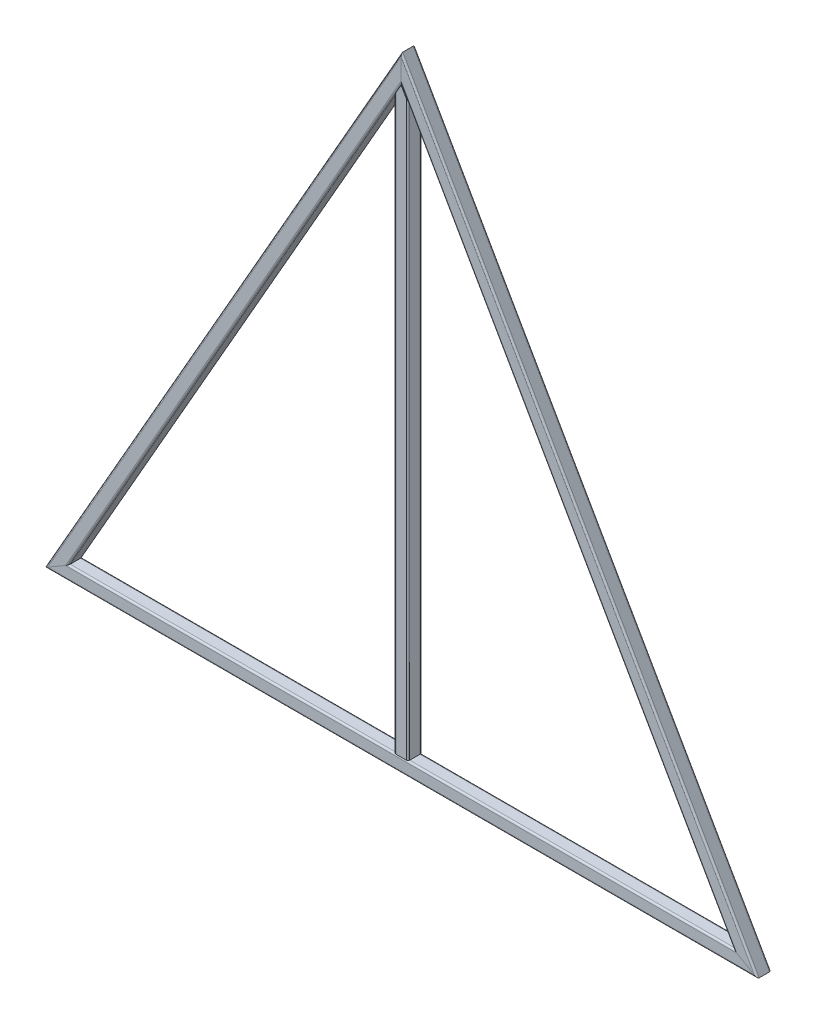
SolidWorks part; units mm, degrees
ref_plane "Front" through (0, 0, 0) normal (0, 0, 1) x (1, 0, 0)
ref_plane "Top" through (0, 0, 0) normal (0, 1, 0) x (1, 0, 0)
ref_plane "Right" through (0, 0, 0) normal (1, 0, 0) x (0, 0, -1)
sketch "Sketch1" plane through (0, 0, 0) normal (0, 0, 1) x (1, 0, 0)
  line L0 (-2000, 0) -> (2000, 0)
  line L1 (2000, 0) -> (0, 3500)
  line L2 (0, 3500) -> (-2000, 0)
  line L3 (0, 3500) -> (0, 0)
  dimension "D1" = 3500
  dimension "D2" = 4000
other "Square tube 80 X 80 X 5(1)"
ref_plane "Plane1" through (2000, 0, 0) normal (-0.4961, 0.8682, 0) x (-0.8682, -0.4961, 0)
sketch "Sketch11" plane through (2000, 0, 0) normal (-0.4961, 0.8682, 0) x (-0.8682, -0.4961, 0)
  line L0 (-30, -35) -> (30, -35)
  line L1 (-35, -30) -> (-35, 30)
  line L2 (30, 35) -> (-30, 35)
  line L3 (35, 30) -> (35, -30)
  line L4 (-30, -40) -> (30, -40)
  line L5 (-40, -30) -> (-40, 30)
  line L6 (30, 40) -> (-30, 40)
  line L7 (40, 30) -> (40, -30)
  arc A0 (40, 30) -> (30, 40) centre (30, 30) ccw
  arc A1 (30, -40) -> (40, -30) centre (30, -30) ccw
  arc A2 (-40, -30) -> (-30, -40) centre (-30, -30) ccw
  arc A3 (-30, 40) -> (-40, 30) centre (-30, 30) ccw
  arc A4 (-30, 35) -> (-35, 30) centre (-30, 30) ccw
  arc A5 (35, 30) -> (30, 35) centre (30, 30) ccw
  arc A6 (30, -35) -> (35, -30) centre (30, -30) ccw
  arc A7 (-35, -30) -> (-30, -35) centre (-30, -30) ccw
  point P0 (-40, 0)
  point P1 (40, 0)
  point P2 (0, 40)
  point P3 (0, -40)
  point P4 (0, 0)
  point P5 (-40, -40)
  point P6 (40, -40)
  point P7 (40, 40)
  point P8 (-40, 40)
  point P33 (0, 0)
  dimension "D1" = 10
  dimension "Thickness" = 5
  dimension "V_leg" = 80
